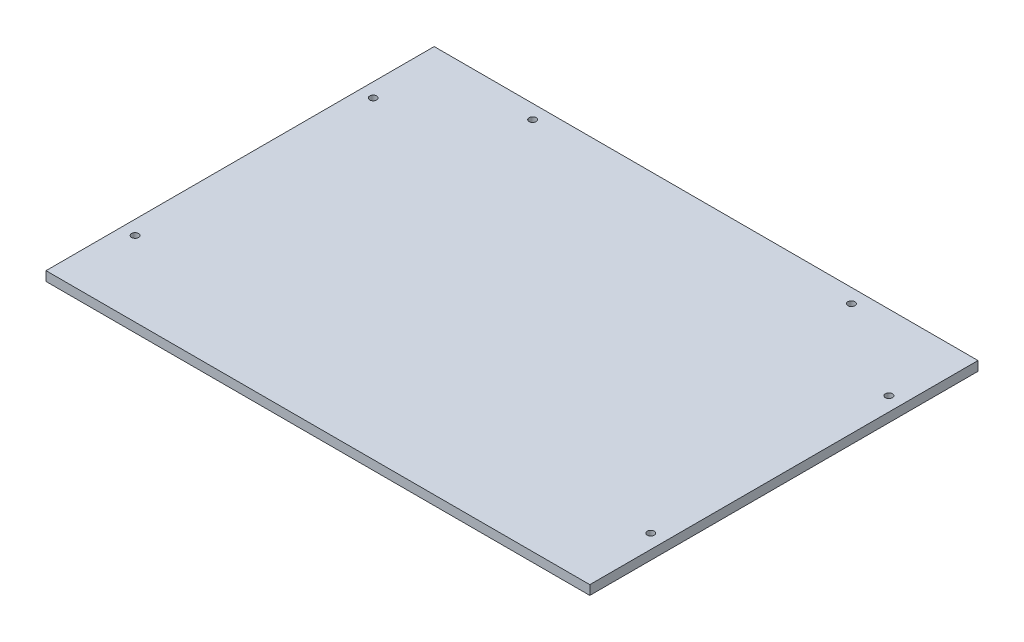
SolidWorks part; units mm, degrees
ref_plane "Front Plane" through (0, 0, 0) normal (0, 0, 1) x (1, 0, 0)
ref_plane "Top Plane" through (0, 0, 0) normal (0, 1, 0) x (1, 0, 0)
ref_plane "Right Plane" through (0, 0, 0) normal (1, 0, 0) x (0, 0, -1)
sketch "Sketch1" plane through (0, 0, 0) normal (0, 1, 0) x (1, 0, 0)
  line L1 (0, 0) -> (736.6, 0)
  line L2 (0, 0) -> (0, 525.78)
  line L3 (0, 525.78) -> (736.6, 525.78)
  line L4 (736.6, 0) -> (736.6, 525.78)
  dimension "D1" = 525.78
  dimension "D2" = 736.6
extrude "Extrude1" add sketch "Sketch1" along normal blind 12.7
sketch "Sketch2" plane through (0, 12.7, 0) normal (0, 1, 0) x (1, 0, 0)
  line L0 (0, 525.78) -> (0, 0) construction
  line L1 (736.6, 525.78) -> (0, 525.78) construction
  line L2 (0, 0) -> (736.6, 0) construction
  line L3 (368.3, 525.78) -> (368.3, -38.8025) construction
  circle A0 centre (19.05, 424.18) radius 4.7625
  circle A1 centre (19.05, 101.6) radius 4.7625
  circle A2 centre (717.55, 101.6) radius 4.7625
  circle A3 centre (717.55, 424.18) radius 4.7625
  dimension "D1" = 9.525
  dimension "D2" = 19.05
  dimension "D3" = 322.58
  dimension "D4" = 101.6
  dimension "D5" = 101.6
extrude "barrel nuts sides" cut sketch "Sketch2" against normal through all
sketch "Sketch3" plane through (0, 12.7, 0) normal (0, 1, 0) x (1, 0, 0)
  line L0 (736.6, 525.78) -> (0, 525.78) construction
  line L1 (0, 525.78) -> (0, 0) construction
  line L3 (736.6, 0) -> (736.6, 525.78) construction
  circle A0 centre (152.4, 506.73) radius 4.7625
  circle A1 centre (584.2, 506.73) radius 4.7625
  dimension "D1" = 9.525
  dimension "D2" = 19.05
  dimension "D4" = 431.8
  dimension "D3" = 152.4
  dimension "D5" = 152.4
extrude "barrel nuts top" cut sketch "Sketch3" against normal through all
